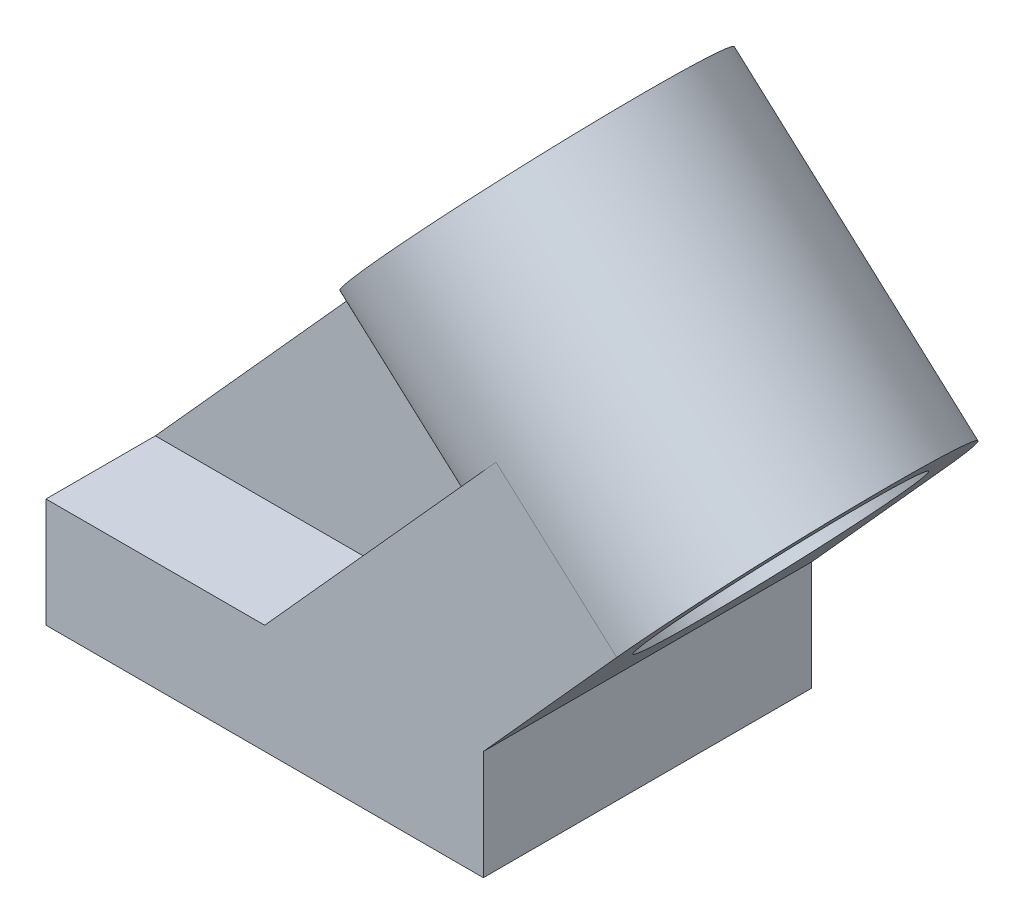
SolidWorks part; units mm, degrees
ref_plane "Front" through (0, 0, 0) normal (0, 0, 1) x (1, 0, 0)
ref_plane "Top" through (0, 0, 0) normal (0, 1, 0) x (1, 0, 0)
ref_plane "Right" through (0, 0, 0) normal (1, 0, 0) x (0, 0, -1)
sketch "Sketch1" plane through (0, 0, 0) normal (0, 0, 1) x (1, 0, 0)
  line L0 (0, 0) -> (101.6, 0)
  line L1 (101.6, 0) -> (101.6, 25.4)
  line L2 (101.6, 25.4) -> (132.5917, 59.8197)
  line L3 (132.5917, 59.8197) -> (104.5367, 85.0806)
  line L4 (104.5367, 85.0806) -> (50.8, 25.4)
  line L5 (50.8, 25.4) -> (0, 25.4)
  line L6 (0, 25.4) -> (0, 0)
  line L7 (0, 25.4) -> (76.4816, 110.3415) construction
  line L8 (104.5367, 85.0806) -> (76.4816, 110.3415) construction
  dimension "D1" = 25.4
  dimension "D2" = 50.8
  dimension "D3" = 101.6
  dimension "D4" = 48
  dimension "D5" = 114.3
extrude "Boss-Extrude1" add sketch "Sketch1" along normal blind 76.2
ref_plane "Plane1" through (0, 0, 38.1) normal (0, 0, 1) x (1, 0, 0)
sketch "Sketch3" plane through (43.4796, -39.1492, 0) normal (0.7431, -0.6691, 0) x (0, 0, -1)
  line L0 (-76.2, 133.1759) -> (0, 133.1759) construction
  circle A0 centre (-38.1, 133.1759) radius 38.1
extrude "Boss-Extrude2" add sketch "Sketch3" against normal blind 76.2
sketch "Sketch4" plane through (43.4796, -39.1492, 0) normal (0.7431, -0.6691, 0) x (0, 0, -1)
  circle A0 centre (-38.1, 133.1759) radius 28.575
  arc A1 (0, 133.1759) -> (-76.2, 133.1759) centre (-38.1, 133.1759) ccw construction
  dimension "D1" = 57.15
extrude "Cut-Extrude1" cut sketch "Sketch4" against normal through all
sketch "Sketch5" plane through (0, 0, 38.1) normal (0, 0, 1) x (1, 0, 0)
  line L0 (0, 25.4) -> (51.285, 82.3578)
rib "Rib1" sketch "Sketch5" sketch "Sketch5" thickness 25.4 extrusion direction parallel to sketch draft on no parameters "D1"=25.4
